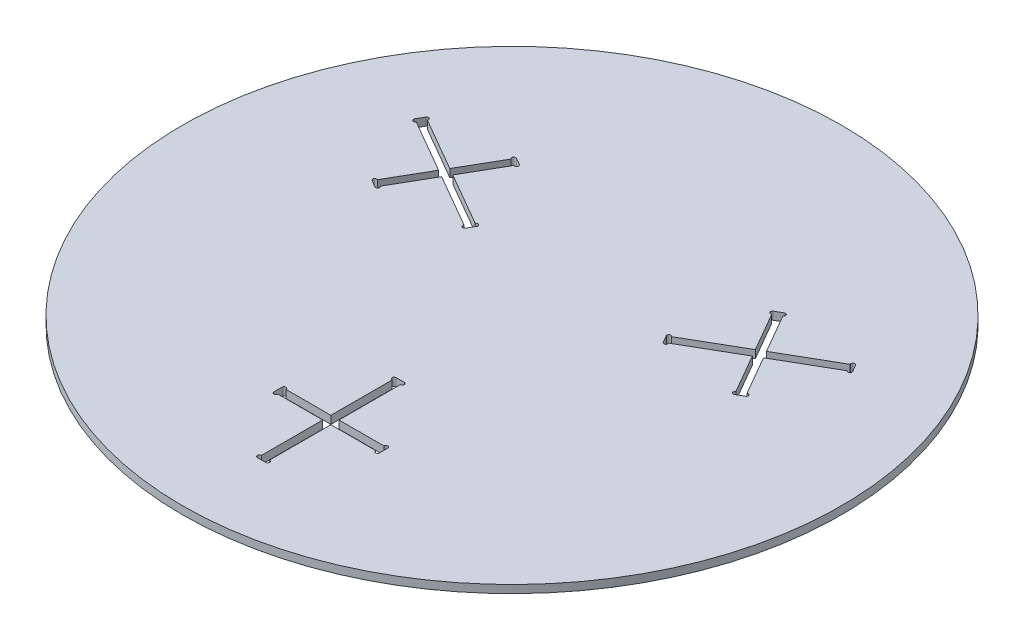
SolidWorks part; units mm, degrees
ref_plane "Front Plane" through (0, 0, 0) normal (0, 0, 1) x (1, 0, 0)
ref_plane "Top Plane" through (0, 0, 0) normal (0, 1, 0) x (1, 0, 0)
ref_plane "Right Plane" through (0, 0, 0) normal (1, 0, 0) x (0, 0, -1)
sketch "Tabletop" plane through (0, 0, 0) normal (0, 1, 0) x (1, 0, 0)
  circle A0 centre (0, 0) radius 500
  dimension "Table_Diameter" = 1000
extrude "Tabletop_Thickness_Extrude" add sketch "Tabletop" along normal mid plane 12
sketch "Leg_Slots" plane through (0, 6, 0) normal (0, 1, 0) x (1, 0, 0)
  line L0 (0, 0) -> (0, -500) construction
  line L1 (-6.2, -380) -> (6.2, -380)
  line L2 (-6.2, -374) -> (-6.2, -281)
  line L3 (-6.2, -169.6) -> (6.2, -169.6)
  line L4 (6.2, -374) -> (6.2, -281)
  line L5 (-80.2, -268.6) -> (80.2, -281) construction
  line L6 (-74.2, -268.6) -> (-6.2, -268.6)
  line L7 (-80.2, -268.6) -> (-80.2, -281)
  line L8 (-74.2, -281) -> (-6.2, -281)
  line L9 (80.2, -268.6) -> (80.2, -281)
  line L10 (-6.2, -374) -> (6.2, -175.6) construction
  line L11 (-6.2, -268.6) -> (-6.2, -175.6)
  line L14 (6.2, -268.6) -> (74.2, -268.6)
  line L15 (6.2, -281) -> (74.2, -281)
  line L16 (6.2, -268.6) -> (6.2, -175.6)
  circle A0 centre (0, 0) radius 500 construction
  arc A1 (-6.2, -169.6) -> (-6.2, -175.6) centre (-6.2, -172.6) ccw
  arc A2 (-6.2, -374) -> (-6.2, -380) centre (-6.2, -377) ccw
  arc A3 (6.2, -374) -> (6.2, -380) centre (6.2, -377) cw
  arc A4 (6.2, -169.6) -> (6.2, -175.6) centre (6.2, -172.6) cw
  arc A5 (-74.2, -268.6) -> (-80.2, -268.6) centre (-77.2, -268.6) ccw
  arc A6 (-80.2, -281) -> (-74.2, -281) centre (-77.2, -281) ccw
  arc A7 (74.2, -281) -> (80.2, -281) centre (77.2, -281) ccw
  arc A8 (80.2, -268.6) -> (74.2, -268.6) centre (77.2, -268.6) ccw
  point P15 (0, -380)
  point P18 (0, -169.6)
  point P23 (0, -274.8)
  dimension "Dogbone_Diameter" = 6
  dimension "Edge_Clearance" = 120
  dimension "Slot_Thickness" = 6.2
  dimension "Slot_Length" = 210.4
  dimension "Crossbrace_Slot_Length" = 160.4
extrude "Leg_Slot_Cut" cut sketch "Leg_Slots" against normal through all from surface at 0
pattern_circular "Leg_Slot_Pattern" count 3 over 360 about axis through (0, 0, 0) along (0, 1, 0) of "Leg_Slot_Cut"
sketch3d "3DSketch2"
  line L0 (0, 0, 0) -> (0, 1058.5752, 0) construction
equation "\"D1@Tabletop_Thickness_Extrude\" = \"material_thickness@Table.SLDASM\""
equation "\"Dogbone_Diameter@Leg_Slots\"=\"cutter_diameter@Table.SLDASM\""
equation "\"Slot_Length@Leg_Slots\" = ( \"leg_width@Table.SLDASM\" - ( \"leg_shoulder@Table.SLDASM\" * 2 ) ) - ( \"interference@Table.SLDASM\" * 2 )"
equation "\"Slot_Thickness@Leg_Slots\" = ( \"material_thickness@Table.SLDASM\" / 2 ) - \"interference@Table.SLDASM\""
equation "\"Edge_Clearance@Leg_Slots\" = \"edge_clearance@Table.SLDASM\" + \"leg_shoulder@Table.SLDASM\""
equation "\"D1@Leg_Slot_Pattern\" = \"leg_count@Table.SLDASM\""
equation "\"Table_Diameter@Tabletop\" = \"table_diameter@Table.SLDASM\""
equation "\"Crossbrace_Slot_Length@Leg_Slots\"= ( \"crossbrace_width@Table.SLDASM\" - ( \"leg_shoulder@Table.SLDASM\" * 2 ) ) - ( \"interference@Table.SLDASM\" * 2 )"
